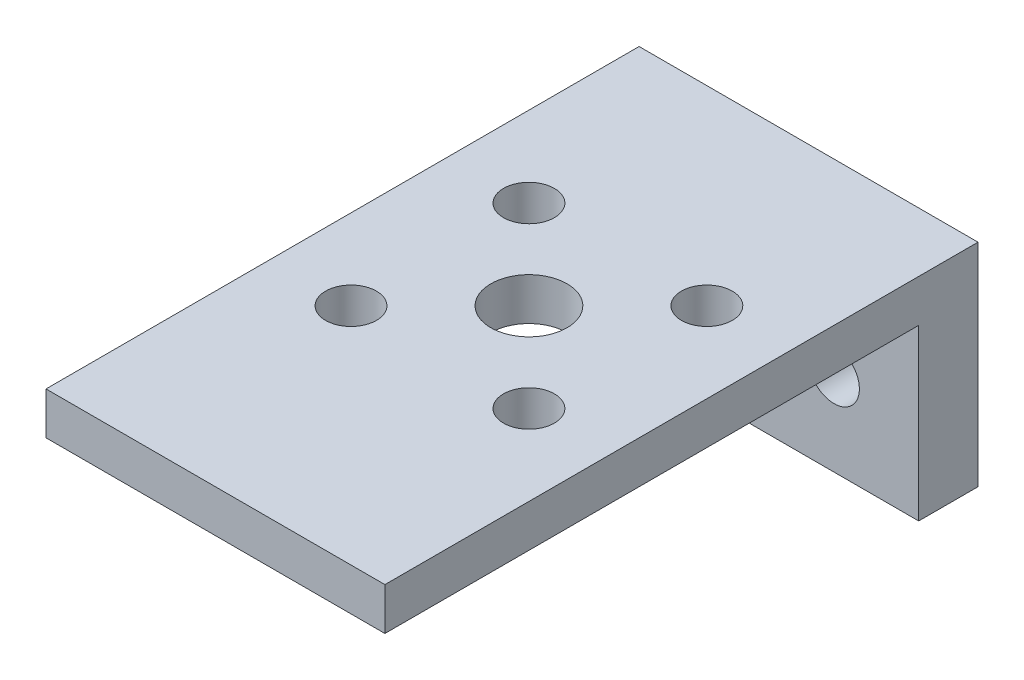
SolidWorks part; units mm, degrees
ref_plane "Front Plane" through (0, 0, 0) normal (0, 0, 1) x (1, 0, 0)
ref_plane "Top Plane" through (0, 0, 0) normal (0, 1, 0) x (1, 0, 0)
ref_plane "Right Plane" through (0, 0, 0) normal (1, 0, 0) x (0, 0, -1)
sketch "Sketch2" plane through (0, 0, 0) normal (0, 1, 0) x (1, 0, 0)
  line L0 (-10, 20) -> (10, 0) construction
  line L1 (-20, 35) -> (20, 35)
  line L2 (-20, 35) -> (-20, -35)
  line L3 (-20, -35) -> (20, -35)
  line L4 (20, 35) -> (20, -35)
  line L5 (-20, 35) -> (20, -35) construction
  line L6 (-20, -35) -> (20, 35) construction
  line L8 (10, 20) -> (-10, 0) construction
  point P0 (0, 0)
  point P6 (0, 0)
  point P16 (0, 0)
  dimension "D1" = 70
  dimension "D2" = 40
  dimension "D3" = 20
extrude "Boss-Extrude1" add sketch "Sketch2" along normal blind 5
sketch "Sketch3" plane through (0, 5, 0) normal (0, 1, 0) x (1, 0, 0)
  line L0 (-20, -25) -> (-10, -25) construction
  line L1 (-20, 35) -> (-20, -35) construction
  line L2 (-10, -25) -> (-10, -35) construction
  line L3 (-20, -35) -> (20, -35) construction
  dimension "D1" = 10
  dimension "D2" = 10
sketch "Sketch4" plane through (0, 0, 0) normal (0, -1, 0) x (1, 0, 0)
  line L0 (-20, -35) -> (-20, 35) construction
  line L1 (20, -35) -> (-20, -35)
  line L2 (20, -35) -> (20, -28)
  line L3 (20, -28) -> (-20, -28)
  line L4 (-20, -35) -> (-20, -28)
  line L5 (20, -35) -> (-20, -28) construction
  line L6 (20, -28) -> (-20, -35) construction
  point P4 (0, -31.5)
  dimension "D1" = 7
extrude "Boss-Extrude2" add sketch "Sketch4" along normal blind 20
sketch "Sketch5" plane through (0, 0, -28) normal (0, 0, 1) x (1, 0, 0)
  line L0 (-20, 0) -> (20, -20) construction
  line L1 (20, 0) -> (-20, -20) construction
  line L2 (-10, -10) -> (10, -10) construction
  circle A0 centre (-10, -10) radius 3
  circle A1 centre (10, -10) radius 3
  point P11 (0, -10)
  dimension "D2" = 6
  dimension "D1" = 20
extrude "Cut-Extrude1" cut sketch "Sketch5" against normal blind 20
sketch "Sketch6" plane through (0, 0, 0) normal (0, -1, 0) x (1, 0, 0)
  line L0 (0, -28) -> (0, 24) construction
  line L1 (20, -28) -> (-20, -28) construction
  line L2 (0, 24) -> (0, -2) construction
  line L4 (-10.5, 8.5) -> (10.5, 8.5) construction
  line L5 (-10.5, 8.5) -> (-10.5, -12.5) construction
  line L6 (-10.5, -12.5) -> (10.5, -12.5) construction
  line L7 (10.5, 8.5) -> (10.5, -12.5) construction
  line L8 (-10.5, 8.5) -> (10.5, -12.5) construction
  line L9 (-10.5, -12.5) -> (10.5, 8.5) construction
  circle A0 centre (0, -2) radius 4.5
  circle A1 centre (10.5, 8.5) radius 3
  circle A3 centre (-10.5, -12.5) radius 3
  circle A4 centre (10.5, -12.5) radius 3
  circle A5 centre (-10.5, 8.5) radius 3
  dimension "D2" = 9
  dimension "D5" = 6
  dimension "D1" = 52
  dimension "D3" = 21
  dimension "D4" = 21
extrude "Cut-Extrude2" cut sketch "Sketch6" against normal blind 10
